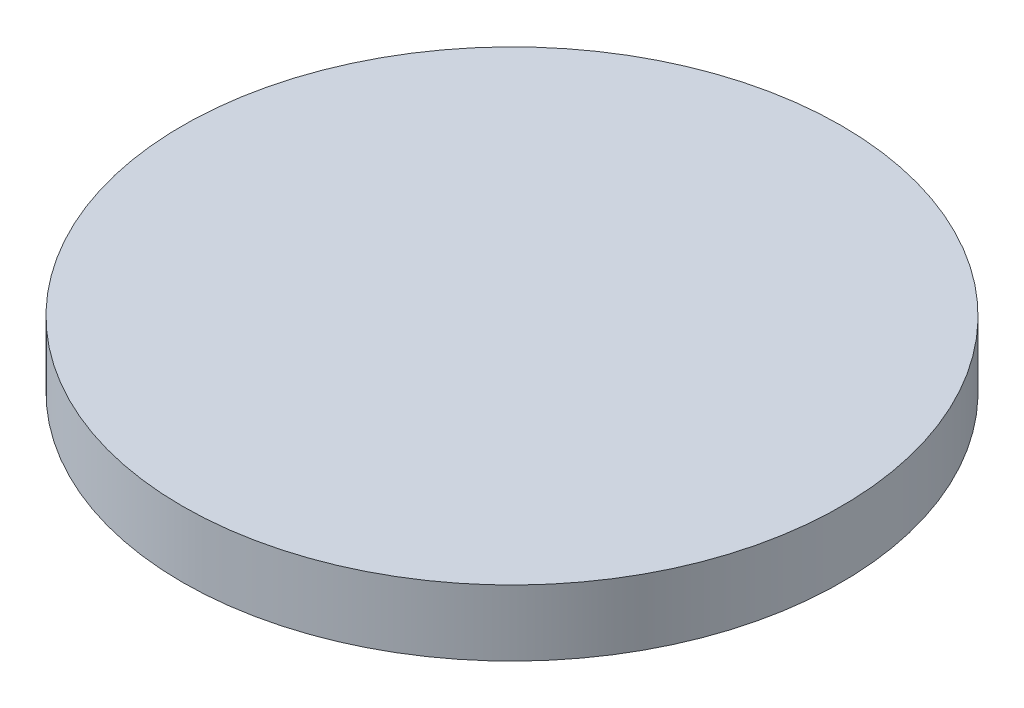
SolidWorks part; units mm, degrees
ref_plane "Front Plane" through (0, 0, 0) normal (0, 0, 1) x (1, 0, 0)
ref_plane "Top Plane" through (0, 0, 0) normal (0, 1, 0) x (1, 0, 0)
ref_plane "Right Plane" through (0, 0, 0) normal (1, 0, 0) x (0, 0, -1)
sketch "Sketch1" plane through (0, 0, 0) normal (0, 1, 0) x (1, 0, 0)
  circle A0 centre (0, 0) radius 15
  dimension "D1" = 30
extrude "Boss-Extrude1" add sketch "Sketch1" along normal blind 3
